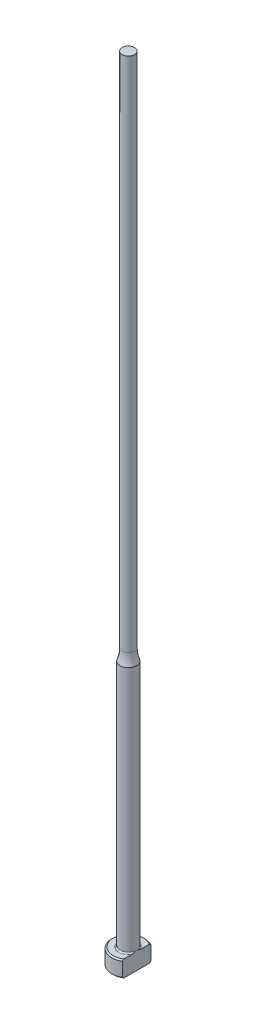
SolidWorks part; units mm, degrees
ref_plane "Front Plane" through (0, 0, 0) normal (0, 0, 1) x (1, 0, 0)
ref_plane "Top Plane" through (0, 0, 0) normal (0, 1, 0) x (1, 0, 0)
ref_plane "Right Plane" through (0, 0, 0) normal (1, 0, 0) x (0, 0, -1)
sketch "Sketch1" plane through (0, 0, 0) normal (0, 0, 1) x (1, 0, 0)
  line L0 (0, 259.9588) -> (0, -15.1925) construction
  line L1 (0, 0) -> (-3.175, 0)
  line L2 (-3.175, 0) -> (-3.175, 3.175)
  line L3 (-3.175, 3.175) -> (-1.5875, 3.175)
  line L4 (-1.19, 53.0114) -> (-1.19, 152.4)
  line L5 (-1.19, 152.4) -> (0, 152.4)
  line L6 (0, 152.4) -> (0, 0)
  line L7 (-1.5875, 3.175) -> (-1.5875, 50.8)
  arc A0 (-1.5875, 50.8) -> (-1.19, 53.0114) centre (-7.54, 53.0114) ccw
  point P13 (-1.5875, 0)
  dimension "D1" = 6.35
  dimension "L" = 152.4
  dimension "D2" = 3.175
  dimension "H" = 6.35
  dimension "T" = 3.175
  dimension "D" = 2.38
  dimension "S" = 50.8
revolve "Revolve1" add sketch "Sketch1" angle 360 about L0
chamfer "Chamfer1" distance 0.254 angle 45 2 edges at (0, 3.175, 3.175) (0, 0, 3.175)
fillet "Fillet1" radius 0.254 1 edges at (0, 3.175, 1.5875)
sketch "Sketch2" plane through (0, 0, 0) normal (0, 1, 0) x (1, 0, 0)
  line L0 (1.5875, -2.7496) -> (1.5875, 2.7496)
  circle A0 centre (0, 0) radius 3.175 construction
  arc A2 (1.5875, -2.7496) -> (1.5875, 2.7496) centre (0, 0) ccw
  circle A3 centre (0, 0) radius 3.175 construction
  circle A4 centre (0, 0) radius 1.5875 construction
extrude "Key Head" cut sketch "Sketch2" along normal up to next
